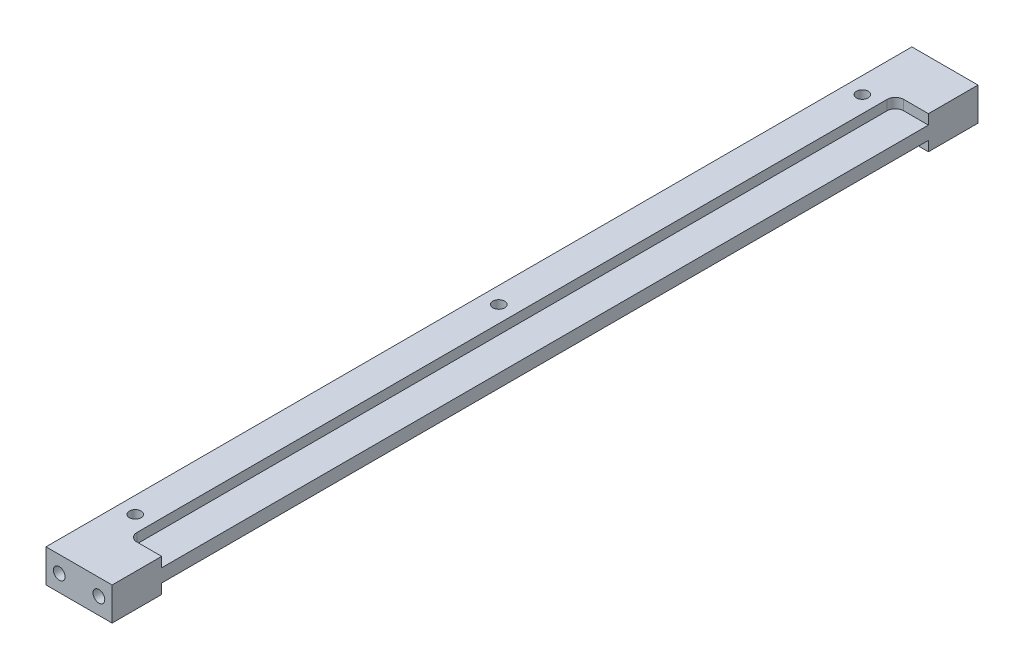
SolidWorks part; units mm, degrees
ref_plane "Front" through (0, 0, 0) normal (0, 0, 1) x (1, 0, 0)
ref_plane "Top" through (0, 0, 0) normal (0, 1, 0) x (1, 0, 0)
ref_plane "Right" through (0, 0, 0) normal (1, 0, 0) x (0, 0, -1)
sketch "Sketch1" plane through (0, 0, 0) normal (0, 0, 1) x (1, 0, 0)
  line L2 (-66.675, -63.5) -> (-53.975, -63.5)
  line L3 (-66.675, -63.5) -> (-66.675, -57.15)
  line L4 (-66.675, -57.15) -> (-53.975, -57.15)
  line L5 (-53.975, -63.5) -> (-53.975, -57.15)
  dimension "D1" = 6.35
  dimension "D2" = 12.7
extrude "Base-Extrude" add sketch "Sketch1" along normal blind 166.37
sketch "Sketch2" plane through (0, -57.15, 0) normal (0, 1, 0) x (-1, 0, 0)
  line L0 (66.675, 166.37) -> (66.675, 0) construction
  line L1 (53.975, 0) -> (66.675, 0) construction
  line L2 (76.2105, 12.7) -> (44.6499, 12.7) construction
  circle A0 centre (63.5, 12.7) radius 1.1303
  dimension "D2" = 2.2606
  dimension "D1" = 12.7
  dimension "D3" = 3.175
extrude "4-40 hole" cut sketch "Sketch2" against normal through all
pattern_linear "4-40 holes" count 3 spacing 69.85
sketch "Sketch3" plane through (0, 0, 166.37) normal (0, 0, 1) x (1, 0, 0)
  line L0 (-66.4041, -60.3033) -> (-53.0467, -60.3033) construction
  line L1 (-66.675, -57.15) -> (-66.675, -63.5) construction
  circle A0 centre (-64.135, -60.3033) radius 1.1303
  circle A1 centre (-56.515, -60.3033) radius 1.1303
  dimension "D1" = 7.62
  dimension "D3" = 2.2606
  dimension "D4" = 2.2606
  dimension "D2" = 2.54
extrude "Cut-Extrude2" cut sketch "Sketch3" against normal blind 9.525
sketch "Sketch4" plane through (0, 0, 0) normal (0, 0, -1) x (-1, 0, 0)
  circle A0 centre (64.135, -60.3033) radius 1.1303 construction
  circle A1 centre (56.515, -60.3033) radius 1.1303 construction
  circle A2 centre (64.135, -60.3033) radius 1.1303
  circle A3 centre (56.515, -60.3033) radius 1.1303
extrude "Cut-Extrude3" cut sketch "Sketch4" against normal blind 9.525
sketch "Sketch5" plane through (0, -63.5, 0) normal (0, -1, 0) x (1, 0, 0)
  line L1 (-53.975, 9.525) -> (-58.7375, 9.525)
  line L2 (-53.975, 166.37) -> (-53.975, 0) construction
  line L3 (-53.975, 156.845) -> (-58.7375, 156.845)
  line L4 (-60.325, 11.1125) -> (-60.325, 155.2575)
  line L5 (-58.7375, 0) -> (-66.675, 0) construction
  line L6 (-53.975, 156.845) -> (-53.975, 9.525)
  line L7 (-66.675, 166.37) -> (-53.975, 166.37) construction
  arc A0 (-60.325, 155.2575) -> (-58.7375, 156.845) centre (-58.7375, 155.2575) cw
  arc A1 (-58.7375, 9.525) -> (-60.325, 11.1125) centre (-58.7375, 11.1125) cw
  dimension "D4" = 1.5875
  dimension "D1" = 6.35
  dimension "D2" = 9.525
  dimension "D3" = 9.525
extrude "Cut-Extrude4" cut sketch "Sketch5" against normal blind 1.905
sketch "Sketch6" plane through (0, -57.15, 0) normal (0, 1, 0) x (-1, 0, 0)
  line L0 (53.975, 166.37) -> (53.975, 0) construction
  line L1 (53.975, 156.845) -> (58.7375, 156.845) construction
  line L2 (58.7375, 9.525) -> (53.975, 9.525) construction
  line L4 (53.975, 156.845) -> (53.975, 9.525)
  line L5 (53.975, 156.845) -> (58.7375, 156.845)
  line L6 (58.7375, 9.525) -> (53.975, 9.525)
  line L7 (60.325, 155.2575) -> (60.325, 11.1125) construction
  line L8 (60.325, 155.2575) -> (60.325, 11.1125)
  arc A0 (60.325, 155.2575) -> (58.7375, 156.845) centre (58.7375, 155.2575) ccw
  arc A1 (58.7375, 9.525) -> (60.325, 11.1125) centre (58.7375, 11.1125) ccw
  dimension "D1" = 1.5875
extrude "Cut-Extrude5" cut sketch "Sketch6" against normal blind 1.905
